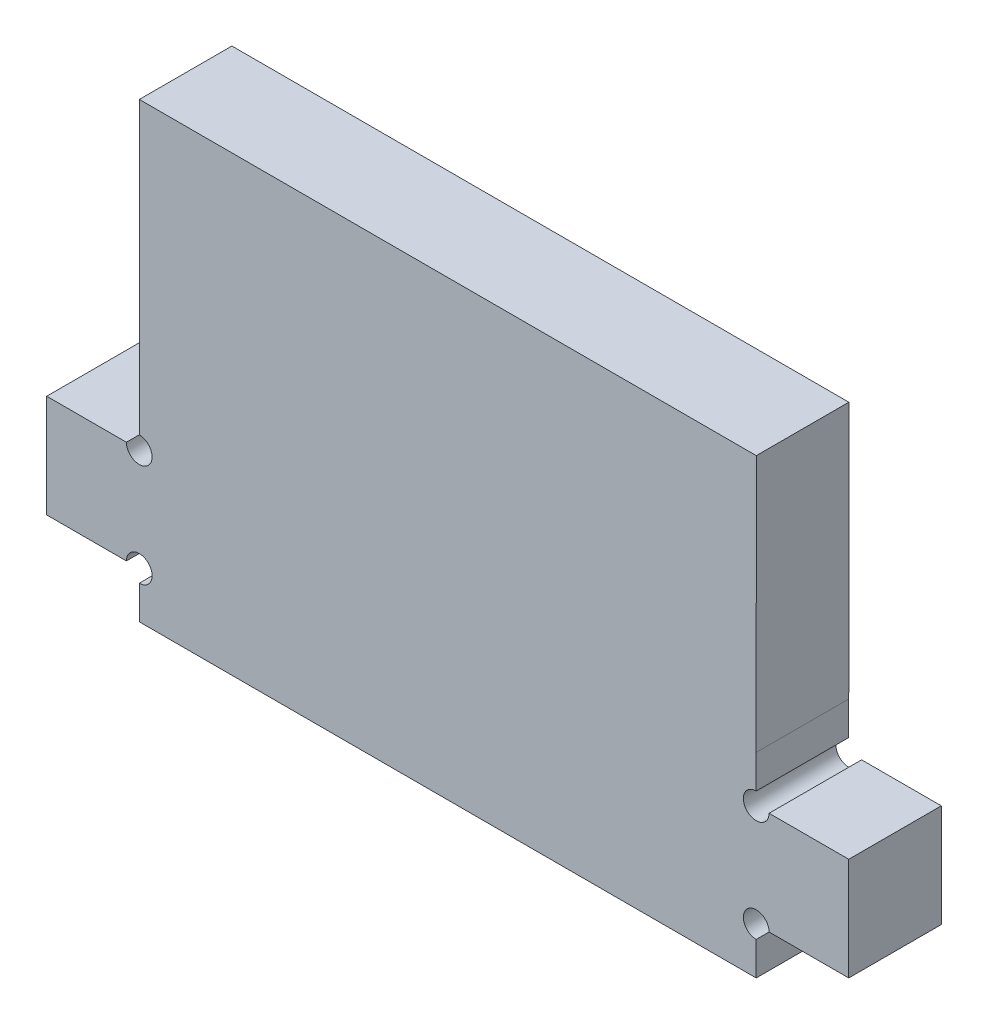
SolidWorks part; units mm, degrees
ref_plane "Front Plane" through (0, 0, 0) normal (0, 0, 1) x (1, 0, 0)
ref_plane "Top Plane" through (0, 0, 0) normal (0, 1, 0) x (1, 0, 0)
ref_plane "Right Plane" through (0, 0, 0) normal (1, 0, 0) x (0, 0, -1)
sketch "Sketch1" plane through (0, 0, 0) normal (0, 0, 1) x (1, 0, 0)
  line L0 (0, 0) -> (99.3876, 0) construction
  line L1 (-60, 19) -> (60, 19)
  line L2 (-60, 12.5) -> (-60, 19)
  line L3 (-60, -19) -> (60, -19)
  line L4 (60, -12.5) -> (60, -19)
  line L5 (78, -10) -> (62.5, -10)
  line L6 (-60, -12.5) -> (-60, -19)
  line L7 (78, -10) -> (78, 10)
  line L8 (-78, -10) -> (-62.5, -10)
  line L9 (-78, -10) -> (-78, 10)
  line L10 (-78, 10) -> (-62.5, 10)
  line L11 (0, 0) -> (0, 65.9672) construction
  line L12 (-78, -10) -> (-60, 0) construction
  line L13 (-78, 10) -> (-60, 0) construction
  line L14 (78, 10) -> (62.5, 10)
  line L15 (60, 12.5) -> (60, 19)
  arc A0 (-62.5, 10) -> (-60, 12.5) centre (-60, 10) ccw
  arc A1 (-60, -12.5) -> (-62.5, -10) centre (-60, -10) ccw
  arc A2 (60, -12.5) -> (62.5, -10) centre (60, -10) cw
  arc A3 (62.5, 10) -> (60, 12.5) centre (60, 10) cw
  point P0 (0, 0)
  point P7 (-60, 0)
  point P21 (0, -19)
  point P23 (-78, 0)
  point P31 (0, 19)
  dimension "D5" = 5
  dimension "D6" = 5
  dimension "D3" = 18
  dimension "D1" = 60
  dimension "D4" = 20
extrude "Boss-Extrude1" add sketch "Sketch1" along normal blind 18
sketch "Sketch2" plane through (0, 0, 18) normal (0, 0, 1) x (1, 0, 0)
  line L0 (0, 0) -> (0, 53.29) construction
  line L1 (-59.9826, 69) -> (-59.9826, 19)
  line L2 (-60, 19) -> (0, 19)
  line L3 (-59.9826, 69) -> (60.0174, 69)
  line L4 (60.0174, 69) -> (60, 19)
  line L5 (0, 0) -> (60.0174, 69) construction
  line L6 (-59.9826, 69) -> (0, 0) construction
  line L7 (60, 19) -> (-60, 19) construction
  line L8 (0, 53.29) -> (-52.7049, 53.29) construction
  line L9 (-60, 19) -> (-59.9826, 19)
  line L11 (0, 19) -> (60, 19)
  point P0 (0, 0)
  dimension "D1" = 34.29
  dimension "D2" = 50
  dimension "D3" = 120
extrude "Boss-Extrude2" add sketch "Sketch2" against normal up to surface (18 mm away) contours L4 L3 L1 M16
